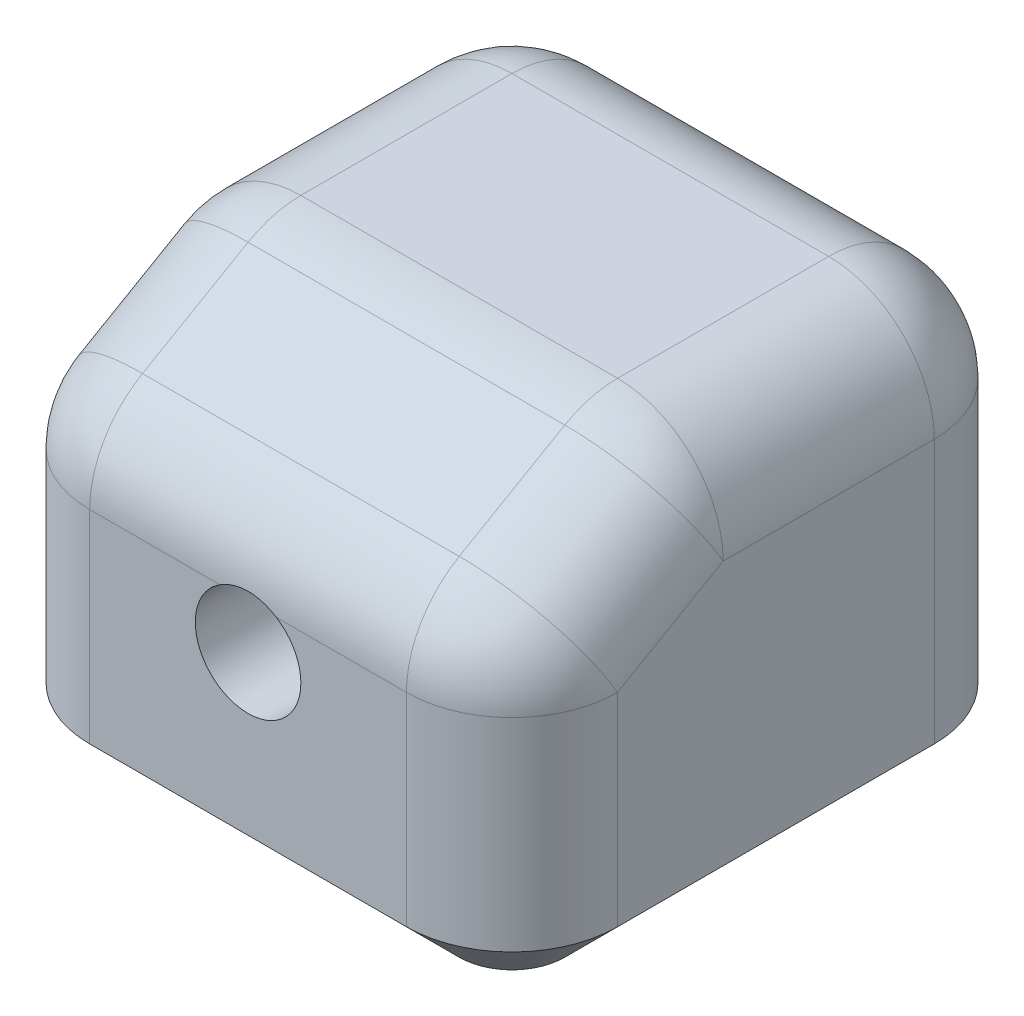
SolidWorks part; units mm, degrees
ref_plane "Front" through (0, 0, 0) normal (0, 0, 1) x (1, 0, 0)
ref_plane "Top" through (0, 0, 0) normal (0, 1, 0) x (1, 0, 0)
ref_plane "Right" through (0, 0, 0) normal (1, 0, 0) x (0, 0, -1)
sketch "Эскиз2" plane through (0, 0, 0) normal (0, 1, 0) x (1, 0, 0)
  line L1 (-19.4081, 33.7655) -> (30.5919, 33.7655)
  line L2 (-19.4081, 33.7655) -> (-19.4081, -16.2345)
  line L3 (-19.4081, -16.2345) -> (30.5919, -16.2345)
  line L4 (30.5919, 33.7655) -> (30.5919, -16.2345)
extrude "Вытянуть1" add sketch "Эскиз2" along normal blind 40
sketch "Эскиз3" plane through (0, 0, 16.2345) normal (0, 0, 1) x (1, 0, 0)
  line L0 (30.5919, 40) -> (30.5919, 0) construction
  line L1 (-19.4081, 40) -> (30.5919, 40) construction
  circle A0 centre (5.5919, 20) radius 5
  dimension "D1" = 25
  dimension "D2" = 20
extrude "Вырез-Вытянуть1" cut sketch "Эскиз3" against normal blind 10
fillet "Скругление1" radius 10 4 edges at (-19.4081, 20, -33.7655) (30.5919, 20, -33.7655) (30.5919, 20, 16.2345) (-19.4081, 20, 16.2345)
chamfer "Фаска2" distance 10 angle 60 1 edges at (5.5919, 40, 16.2345)
chamfer "Фаска3" distance 5 angle 45 8 edges at (5.5919, 0, -33.7655) (-16.4792, 0, -30.8366) (27.6629, 0, -30.8366) (-19.4081, 0, -8.7655) (30.5919, 0, -8.7655) (-16.4792, 0, 13.3056) (27.6629, 0, 13.3056) (5.5919, 0, 16.2345)
fillet "Скругление2" radius 10 11 edges at (27.6629, 40, -30.8366) (-16.4792, 40, -30.8366) (5.5919, 40, -33.7655) (30.5919, 40, -12.4258) (-19.4081, 40, -12.4258) (5.5919, 40, -1.086) (5.5919, 30, 16.2345) (-16.4792, 31.691, 13.3056) (-19.4081, 37.8868, 2.5742) (30.5919, 37.8868, 2.5742) (27.6629, 31.691, 13.3056)
